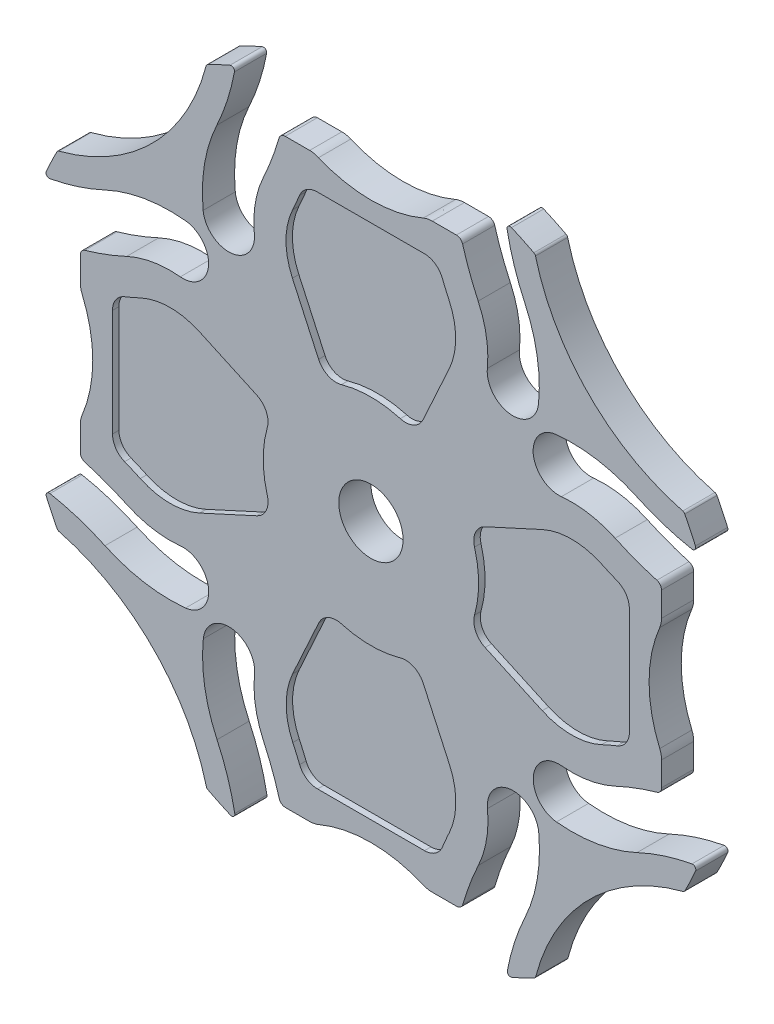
SolidWorks part; units mm, degrees
ref_plane "Plane1" through (0, 0, 0) normal (0, 0, 1) x (1, 0, 0)
ref_plane "Plane2" through (0, 0, 0) normal (0, 1, 0) x (1, 0, 0)
ref_plane "Plane3" through (0, 0, 0) normal (1, 0, 0) x (0, 0, -1)
imported_body "Imported1"
sketch "Sketch1" plane through (0, 0, 0) normal (0, 0, 1) x (1, 0, 0)
  line L0 (244.9077, 470.0765) -> (246.741, 339.1068)
  line L1 (70.8136, 167.284) -> (-60.156, 165.4507)
  line L2 (-231.9789, 341.3781) -> (-233.8121, 472.3477)
  line L3 (-57.8848, 644.1706) -> (73.0849, 646.0038)
  arc A0 (246.741, 339.1068) -> (244.9077, 470.0765) centre (326.9559, 405.7273) cw
  arc A1 (-60.156, 165.4507) -> (70.8136, 167.284) centre (6.4644, 85.2358) cw
  arc A2 (-233.8121, 472.3477) -> (-231.9789, 341.3781) centre (-314.027, 405.7273) cw
  arc A3 (73.0849, 646.0038) -> (-57.8848, 644.1706) centre (6.4644, 726.2187) cw
  point P4 (6.4644, 405.7273)
  point P16 (6.4644, 405.7273)
  dimension "D1" = 4
extrude "Cut-Extrude1" cut sketch "Sketch1" against normal through all both and the other way through all
fillet "Fillet1" radius 17.78 8 edges
